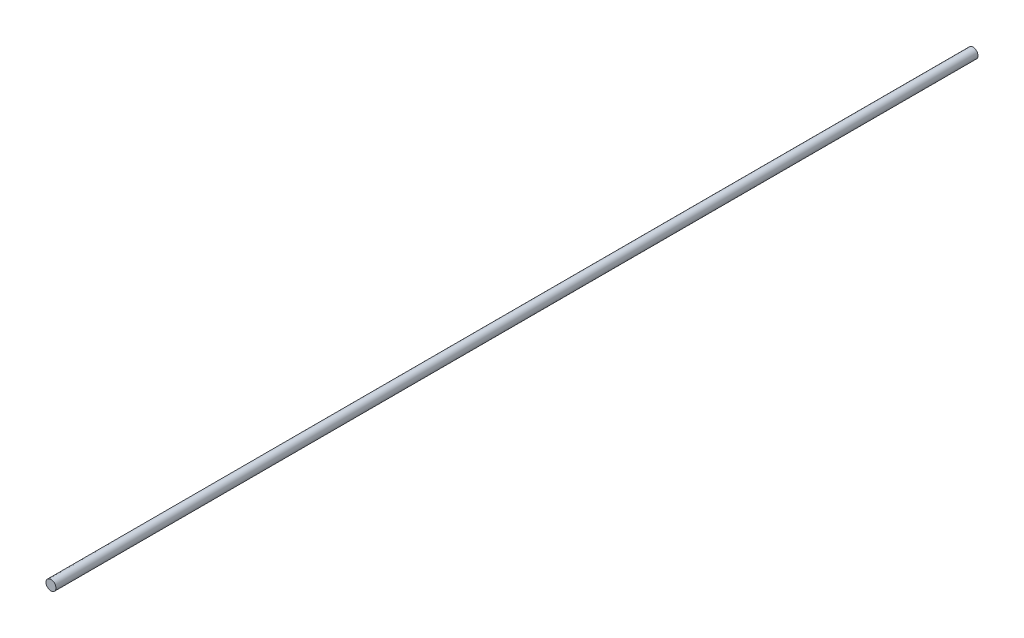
SolidWorks part; units mm, degrees
ref_plane "Face" through (0, 0, 0) normal (0, 0, 1) x (1, 0, 0)
ref_plane "Dessus" through (0, 0, 0) normal (0, 1, 0) x (1, 0, 0)
ref_plane "Droite" through (0, 0, 0) normal (1, 0, 0) x (0, 0, -1)
sketch "Esquisse1" plane through (0, 0, 0) normal (0, 0, 1) x (1, 0, 0)
  circle A0 centre (0, 0) radius 1.35
  dimension "D1" = 2.7
extrude "Extrusion1" add sketch "Esquisse1" along normal blind 250
